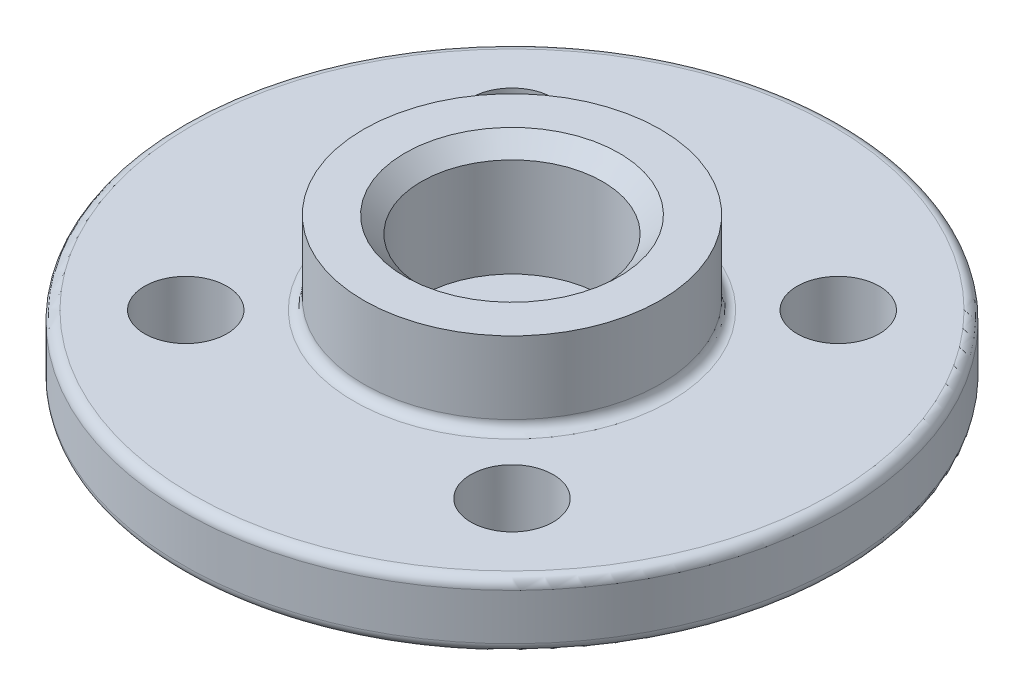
SolidWorks part; units mm, degrees
ref_plane "Front Plane" through (0, 0, 0) normal (0, 0, 1) x (1, 0, 0)
ref_plane "Top Plane" through (0, 0, 0) normal (0, 1, 0) x (1, 0, 0)
ref_plane "Right Plane" through (0, 0, 0) normal (1, 0, 0) x (0, 0, -1)
sketch "Sketch1" plane through (0, 0, 0) normal (0, 0, 1) x (1, 0, 0)
  line L0 (0, 0) -> (-10, 0)
  line L1 (-10, 0) -> (-10, 2)
  line L2 (-10, 2) -> (-4.5, 2)
  line L3 (-4.5, 2) -> (-4.5, 4.5)
  line L4 (-4.5, 4.5) -> (-2.75, 4.5)
  line L5 (-2.75, 4.5) -> (-2.75, 1)
  line L6 (-2.75, 1) -> (0, 1)
  line L7 (0, 1) -> (0, 0)
  dimension "D1" = 10
  dimension "D2" = 4.5
  dimension "D3" = 2.75
  dimension "D4" = 2
  dimension "D5" = 1
  dimension "D6" = 4.5
revolve "Revolve1" add sketch "Sketch1" angle 360 about L7
chamfer "Chamfer1" distance 0.5 angle 45 1 edges at (-2.75, 4.5, 0)
sketch "Sketch2" plane through (0, 0, 0) normal (0, -1, 0) x (1, 0, 0)
  line L1 (4.9497, -4.9497) -> (-4.9497, -4.9497) construction
  line L2 (4.9497, -4.9497) -> (4.9497, 4.9497) construction
  line L3 (4.9497, 4.9497) -> (-4.9497, 4.9497) construction
  line L4 (-4.9497, -4.9497) -> (-4.9497, 4.9497) construction
  line L5 (4.9497, -4.9497) -> (-4.9497, 4.9497) construction
  line L6 (4.9497, 4.9497) -> (-4.9497, -4.9497) construction
  circle A0 centre (-4.9497, 4.9497) radius 1.25
  circle A1 centre (4.9497, 4.9497) radius 1.25
  circle A2 centre (4.9497, -4.9497) radius 1.25
  circle A3 centre (-4.9497, -4.9497) radius 1.25
  circle A4 centre (0, 0) radius 1.5
  point P0 (0, 0)
  dimension "D2" = 2.5
  dimension "D3" = 3
  dimension "D1" = 14
extrude "Cut-Extrude1" cut sketch "Sketch2" against normal through all
chamfer "Chamfer2" distance 0.2 angle 45 4 edges at (6.1997, 0, 4.9497) (6.1997, 0, -4.9497) (-3.6997, 0, 4.9497) (-3.6997, 0, -4.9497)
fillet "Fillet1" radius 0.3 3 edges at (-4.5, 2, 0) (-10, 2, 0) (-10, 0, 0)
